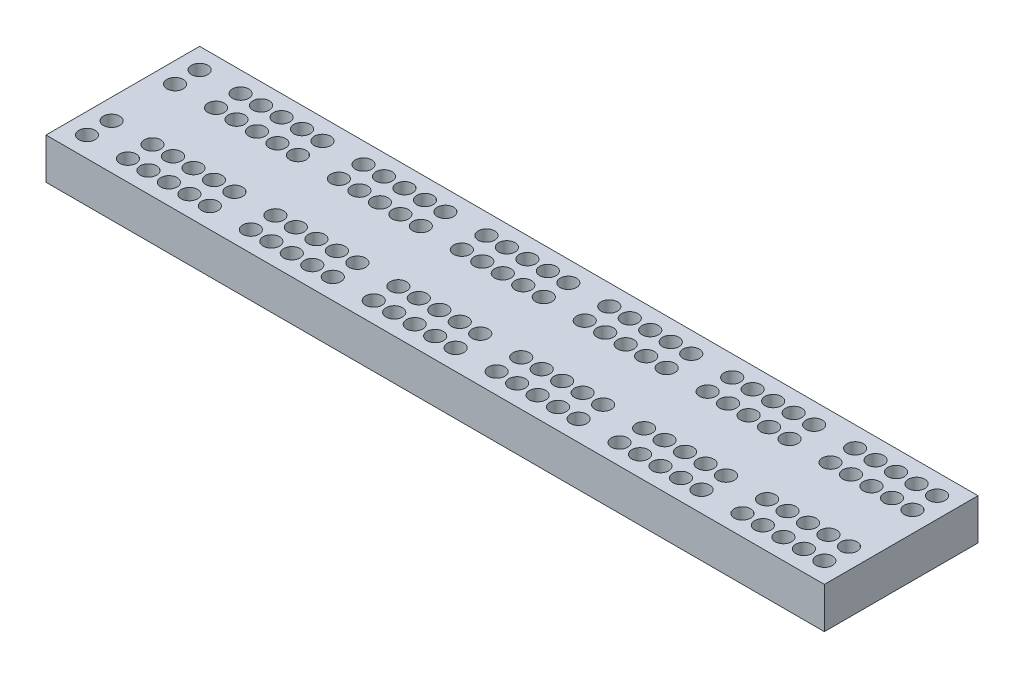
SolidWorks part; units mm, degrees
ref_plane "Front Plane" through (0, 0, 0) normal (0, 0, 1) x (1, 0, 0)
ref_plane "Top Plane" through (0, 0, 0) normal (0, 1, 0) x (1, 0, 0)
ref_plane "Right Plane" through (0, 0, 0) normal (1, 0, 0) x (0, 0, -1)
sketch "Sketch1" plane through (0, 0, 0) normal (1, 0, 0) x (0, 0, -1)
  line L1 (-37.5, 10) -> (37.5, 10)
  line L2 (-37.5, 10) -> (-37.5, -10)
  line L3 (-37.5, -10) -> (37.5, -10)
  line L4 (37.5, 10) -> (37.5, -10)
  line L5 (-37.5, 10) -> (37.5, -10) construction
  line L6 (-37.5, -10) -> (37.5, 10) construction
  point P0 (0, 0)
  dimension "D1" = 20
  dimension "D2" = 75
extrude "Boss-Extrude1" add sketch "Sketch1" along normal mid plane 380
hole_wizard "Ø8.0 (8) Diameter Hole1" positions "Sketch3" profile "Sketch2" hole size "Ø8.0" standard "ANSI Metric"
sketch "Sketch3" plane through (0, 10, 0) normal (0, 1, 0) x (1, 0, 0)
  line L0 (190, 37.5) -> (-190, 37.5) construction
  line L1 (-190, 37.5) -> (-190, -37.5) construction
  point P0 (-180, 27.5)
  dimension "D1" = 10
  dimension "D2" = 10
sketch "Sketch2" plane through (-180, 10, -27.5) normal (1, 0, 0) x (0, 0, 1)
  line L0 (0, 0) -> (0, 14.4034)
  line L1 (0, 14.4034) -> (4, 12)
  line L2 (4, 12) -> (4, 0)
  line L5 (4, 0) -> (0, 0)
  line L10 (0, 14.4034) -> (-4, 12) construction
  line L11 (0, -6.35) -> (0, 107.95) construction
  dimension "Hole Dia." = 8
  dimension "Hole Depth" = 12
  dimension "Drill Angle" = 118
pattern_linear "LPattern1" count 37 spacing 10 along (1, 0, 0) count 2 spacing 12 along (0, 0, 1) of "Ø8.0 (8) Diameter Hole1"
mirror "Mirror1" about plane through (0, 0, 0) normal (0, 0, 1) of "LPattern1", "Ø8.0 (8) Diameter Hole1"
